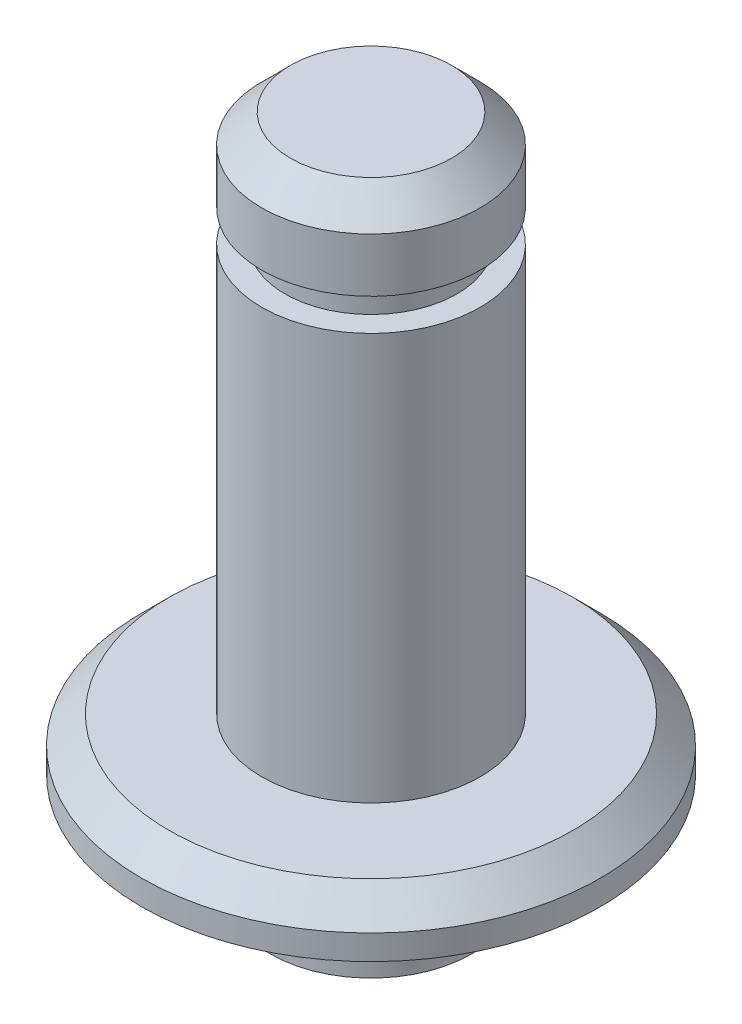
SolidWorks part; units mm, degrees
ref_plane "Front Plane" through (0, 0, 0) normal (0, 0, 1) x (1, 0, 0)
ref_plane "Top Plane" through (0, 0, 0) normal (0, 1, 0) x (1, 0, 0)
ref_plane "Right Plane" through (0, 0, 0) normal (1, 0, 0) x (0, 0, -1)
sketch "Sketch2" plane through (0, 0, 0) normal (1, 0, 0) x (0, 0, -1)
  line L0 (0, 0) -> (0, 86.5522) construction
  line L1 (2.7781, 0) -> (6.35, 0)
  line L2 (2.7781, 0) -> (2.7781, -2.921)
  line L3 (6.35, 0) -> (6.35, 1.4478)
  line L4 (6.35, 1.4478) -> (3.0226, 1.4478)
  line L5 (3.0226, 1.4478) -> (3.0226, 15.875)
  line L6 (3.0226, 15.875) -> (0, 15.875)
  line L7 (0, 15.875) -> (0, -2.921)
  line L8 (0, -2.921) -> (2.7781, -2.921)
  dimension "D1" = 6.0452
  dimension "D2" = 1.4478
  dimension "D3" = 15.875
  dimension "D4" = 12.7
  dimension "D5" = 5.5562
  dimension "D6" = 2.921
revolve "Revolve1" add sketch "Sketch2" angle 360 about L0
chamfer "Chamfer1" distance 0.7937 angle 45 1 edges at (0, 15.875, -3.0226)
chamfer "Chamfer2" distance 0.762 angle 45 1 edges at (0, 1.4478, -6.35)
sketch "Sketch3" plane through (0, 0, 0) normal (1, 0, 0) x (0, 0, -1)
  line L0 (3.0226, 1.4478) -> (3.0226, 15.0813) construction
  line L1 (3.0226, 13.589) -> (2.3813, 13.589)
  line L2 (3.0226, 13.589) -> (3.0226, 12.7)
  line L3 (3.0226, 12.7) -> (2.3813, 12.7)
  line L4 (2.3813, 13.589) -> (2.3813, 12.7)
  line L5 (0, 0) -> (0, 16.4794) construction
  line L6 (-6.35, 0) -> (6.35, 0) construction
  dimension "D1" = 4.7625
  dimension "D2" = 0.889
  dimension "D3" = 12.7
revolve "Cut-Revolve1" cut sketch "Sketch3" angle 360 about L5
